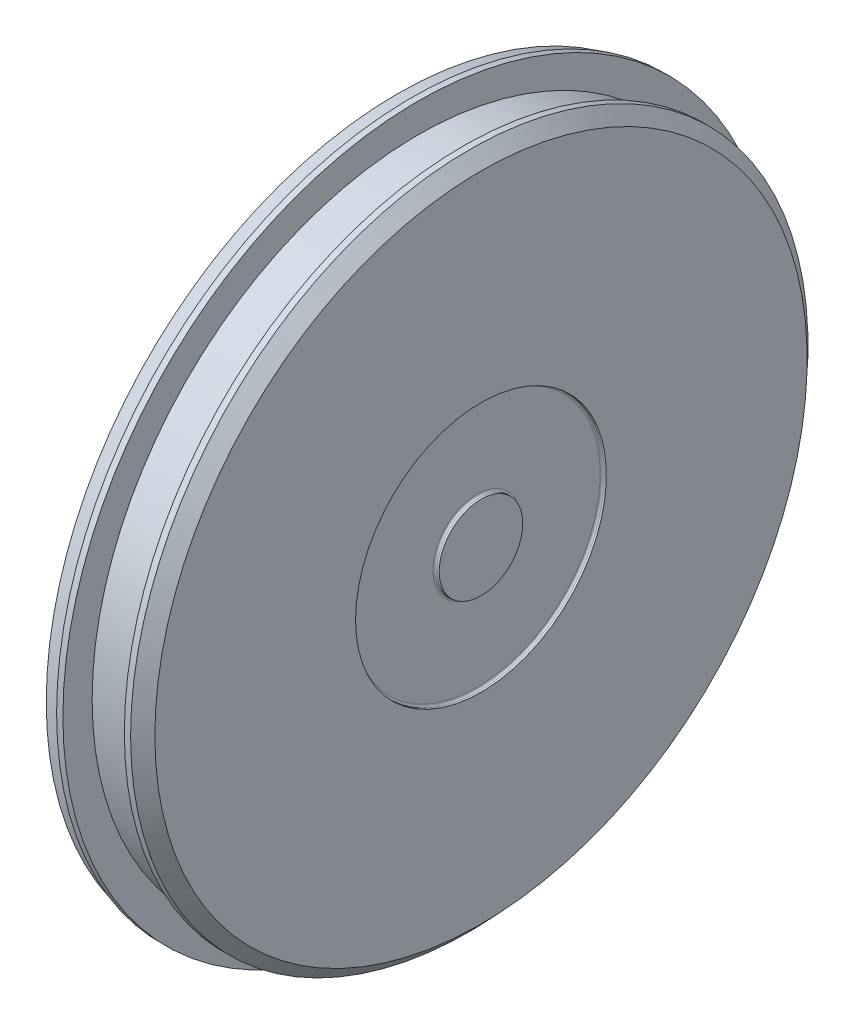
SolidWorks part; units mm, degrees
ref_plane "Plan1" through (0, 0, 0) normal (0, 0, 1) x (1, 0, 0)
ref_plane "Plan2" through (0, 0, 0) normal (0, 1, 0) x (1, 0, 0)
ref_plane "Plan3" through (0, 0, 0) normal (1, 0, 0) x (0, 0, -1)
sketch "Esquisse1" plane through (0, 0, 0) normal (0, 0, 1) x (1, 0, 0)
  line L0 (-110, 0) -> (120, 0) construction
  line L1 (-52.75, 9) -> (-26, 9)
  line L2 (-56, 9.25) -> (-53, 9.25)
  line L3 (-35.5, 85) -> (-34, 85)
  line L4 (-39, 83.9749) -> (-39, 76.64)
  line L5 (-56, 14) -> (-56, 9.25)
  line L7 (-19, 78) -> (-19, 30)
  line L8 (-25, 8) -> (-25, 0)
  line L9 (-34, 85) -> (-34, 78)
  line L10 (-23.3, 81) -> (-21.8, 81)
  line L12 (-34, 78) -> (-23.3, 78)
  line L13 (-23.3, 81) -> (-23.3, 78)
  line L14 (-19.5, 10) -> (-19, 10)
  line L15 (-21.8, 81) -> (-19, 78)
  line L16 (-19.5, 30) -> (-19, 30)
  line L17 (-20, 29.5) -> (-20, 10.5)
  line L18 (-19, 10) -> (-19, 0)
  line L19 (-26, 70.64) -> (-26, 51)
  line L20 (-33, 45) -> (-33, 36)
  line L21 (-56, 14) -> (-38, 14)
  line L22 (-38, 14) -> (-33.8748, 15.1053)
  line L23 (-36, 73.64) -> (-29, 73.64)
  line L24 (-30, 48) -> (-29, 48)
  line L25 (-25.6903, 28.8649) -> (-29.8738, 18.6306)
  line L26 (-30, 33) -> (-28.4673, 33)
  line L27 (-25, 0) -> (-19, 0)
  line L28 (-53, 9.25) -> (-52.75, 9)
  arc A0 (-25, 8) -> (-26, 9) centre (-26, 8) ccw
  arc A1 (-29.8738, 18.6306) -> (-33.8748, 15.1053) centre (-35.4277, 20.9009) cw
  arc A2 (-30, 48) -> (-33, 45) centre (-30, 45) ccw
  arc A3 (-29, 48) -> (-26, 51) centre (-29, 51) ccw
  arc A4 (-30, 33) -> (-33, 36) centre (-30, 36) cw
  arc A5 (-28.4673, 33) -> (-25.6903, 28.8649) centre (-28.4673, 30) cw
  arc A6 (-36, 73.64) -> (-39, 76.64) centre (-36, 76.64) cw
  arc A7 (-29, 73.64) -> (-26, 70.64) centre (-29, 70.64) cw
  arc A8 (-19.5, 30) -> (-20, 29.5) centre (-19.5, 29.5) ccw
  arc A9 (-20, 10.5) -> (-19.5, 10) centre (-19.5, 10.5) ccw
  arc A10 (-35.5, 85) -> (-39, 83.9749) centre (-12.5059, 0) ccw
  point P39 (-31, 15.8756)
  dimension "D4" = 1
  dimension "D23" = 6
  dimension "D20" = 3
  dimension "D25" = 3
  dimension "D26" = 0.5
  dimension "D1" = 9
  dimension "D2" = 9.25
  dimension "D3" = 1.5
  dimension "D5" = 31
  dimension "D6" = 37
  dimension "D7" = 85
  dimension "D8" = 20
  dimension "D9" = 22
  dimension "D10" = 81
  dimension "D12" = 32.7
  dimension "D13" = 10
  dimension "D14" = 30
  dimension "D15" = 36
  dimension "D16" = 7
  dimension "D17" = 14
  dimension "D18" = 14
  dimension "D19" = 15
  dimension "D21" = 33
  dimension "D22" = 25
  dimension "D24" = 15
revolve "Base-Révolution" add sketch "Esquisse1" angle 360 about L0
sketch "Esquisse2" plane through (0, 0, 0) normal (0, 0, 1) x (1, 0, 0)
  line L0 (-56, 9.25) -> (-56, -9.25) construction
  circle A0 centre (-44, 0) radius 4
  dimension "D1" = 8
  dimension "D2" = 12
extrude "Enlèv. mat.-Extru.1" cut sketch "Esquisse2" against normal mid plane 40
ref_point "Point1"
